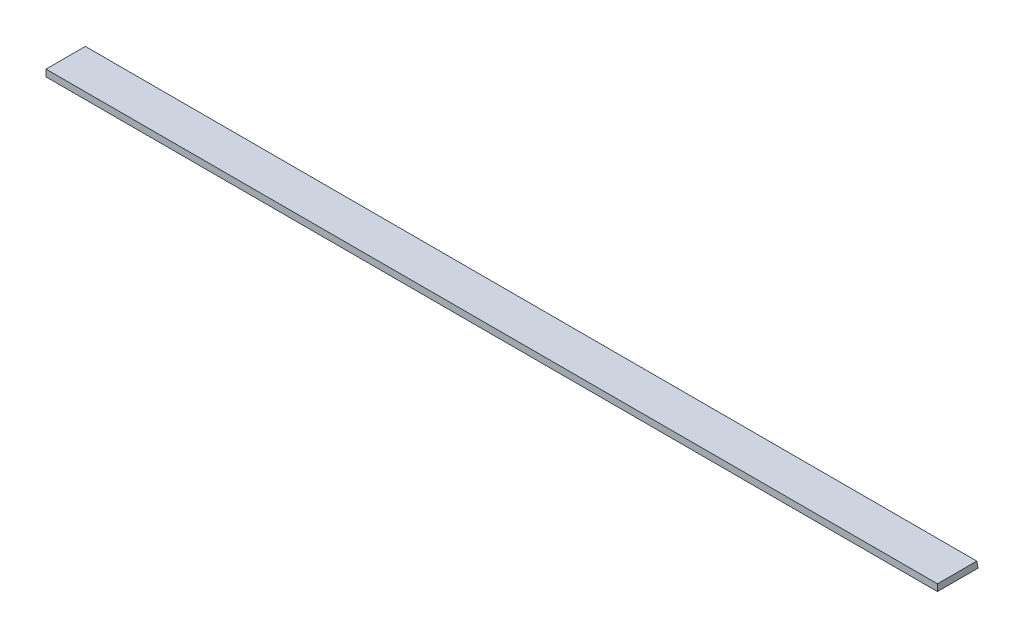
SolidWorks part; units mm, degrees
ref_plane "Plan de face" through (0, 0, 0) normal (0, 0, 1) x (1, 0, 0)
ref_plane "Plan de dessus" through (0, 0, 0) normal (0, 1, 0) x (1, 0, 0)
ref_plane "Plan de droite" through (0, 0, 0) normal (1, 0, 0) x (0, 0, -1)
sketch "Esquisse1" plane through (0, 0, 0) normal (1, 0, 0) x (0, 0, -1)
  line L1 (-15, 5) -> (14.1184, 5)
  line L2 (-15, 5) -> (-15, 0)
  line L3 (-15, 0) -> (15, 0)
  line L4 (14.1184, 5) -> (15, 0)
  dimension "D1" = 5
  dimension "D2" = 30
  dimension "D3" = 80
  dimension "D4" = 90
extrude "Extrusion1" add sketch "Esquisse1" along normal mid plane 660
